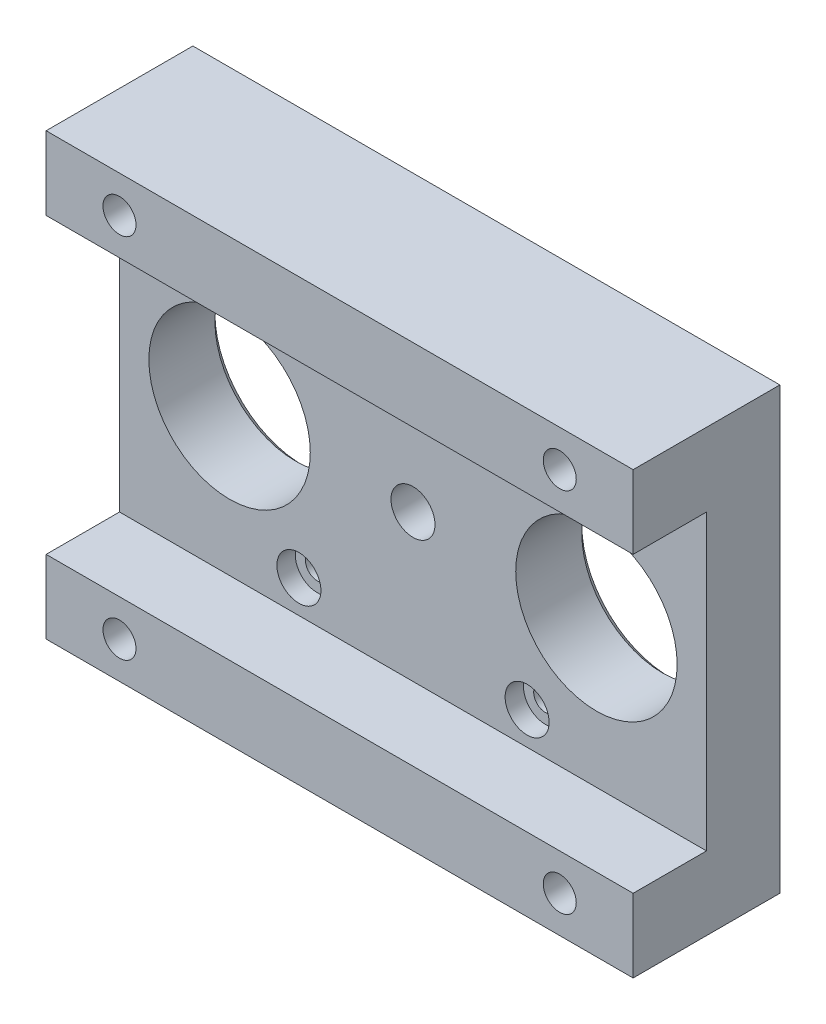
SolidWorks part; units mm, degrees
ref_plane "Ebene vorne" through (0, 0, 0) normal (0, 0, 1) x (1, 0, 0)
ref_plane "Ebene oben" through (0, 0, 0) normal (0, 1, 0) x (1, 0, 0)
ref_plane "Ebene rechts" through (0, 0, 0) normal (1, 0, 0) x (0, 0, -1)
sketch "Skizze1" plane through (0, 0, 0) normal (0, 0, 1) x (1, 0, 0)
  line L1 (-40, 30) -> (40, 30)
  line L2 (-40, 30) -> (-40, -30)
  line L3 (-40, -30) -> (40, -30)
  line L4 (40, 30) -> (40, -30)
  line L5 (-40, 30) -> (40, -30) construction
  line L6 (-40, -30) -> (40, 30) construction
  point P0 (0, 0)
  dimension "D1" = 80
  dimension "D2" = 60
extrude "Aufsatz-Linear austragen1" add sketch "Skizze1" along normal blind 10
sketch "Skizze2" plane through (0, 0, 10) normal (0, 0, 1) x (1, 0, 0)
  line L0 (40, -30) -> (40, 30) construction
  line L1 (-40, 30) -> (40, 30)
  line L2 (-40, 30) -> (-40, 20)
  line L3 (-40, 20) -> (40, 20)
  line L4 (40, 30) -> (40, 20)
  line L5 (-40, 30) -> (-40, -30) construction
  line L6 (40, -30) -> (-40, -30)
  line L7 (40, -30) -> (40, -20)
  line L8 (40, -20) -> (-40, -20)
  line L9 (-40, -30) -> (-40, -20)
  dimension "D1" = 10
  dimension "D2" = 10
extrude "Aufsatz-Linear austragen2" add sketch "Skizze2" along normal blind 10
sketch "Skizze3" plane through (0, 0, 0) normal (0, 0, -1) x (-1, 0, 0)
  circle A0 centre (0, 0) radius 11.35
  dimension "D1" = 22.7
extrude "Schnitt-Linear austragen1" cut sketch "Skizze3" against normal blind 2.2
sketch "Skizze4" plane through (0, 0, 2.2) normal (0, 0, -1) x (-1, 0, 0)
  circle A0 centre (0, 0) radius 3
extrude "Schnitt-Linear austragen2" cut sketch "Skizze4" against normal blind 12.2
sketch "Skizze5" plane through (0, 0, 20) normal (0, 0, 1) x (1, 0, 0)
  line L0 (-40, 20) -> (40, 20) construction
  line L1 (-40, -30) -> (40, -30) construction
  line L2 (40, -30) -> (40, -20) construction
  line L3 (40, 20) -> (40, 30) construction
  line L4 (-40, 30) -> (-40, 20) construction
  line L5 (-40, -20) -> (-40, -30) construction
  circle A0 centre (30, 25) radius 2.25
  circle A1 centre (-30, 25) radius 2.25
  circle A2 centre (-30, -25) radius 2.25
  circle A3 centre (30, -25) radius 2.25
  dimension "D1" = 4.5
  dimension "D2" = 4.5
  dimension "D3" = 4.5
  dimension "D4" = 4.5
  dimension "D5" = 5
  dimension "D6" = 5
  dimension "D7" = 5
  dimension "D8" = 5
  dimension "D9" = 10
  dimension "D10" = 10
  dimension "D11" = 10
  dimension "D12" = 10
extrude "Schnitt-Linear austragen3" cut sketch "Skizze5" against normal blind 12.2
sketch "Skizze6" plane through (0, 0, 10) normal (0, 0, 1) x (1, 0, 0)
  line L0 (40, -20) -> (40, 20) construction
  line L1 (-40, 20) -> (-40, -20) construction
  line L2 (-40, 20) -> (40, 20) construction
  line L3 (40, -20) -> (-40, -20) construction
  circle A0 centre (-25, 0) radius 11
  circle A1 centre (25, 0) radius 11
  dimension "D1" = 22
  dimension "D2" = 22
  dimension "D3" = 15
  dimension "D4" = 15
  dimension "D5" = 20
  dimension "D6" = 20
extrude "Schnitt-Linear austragen4" cut sketch "Skizze6" against normal blind 12.2
sketch "Skizze7" plane through (0, 0, 10) normal (0, 0, 1) x (1, 0, 0)
  line L1 (-15.55, 15.55) -> (15.55, 15.55)
  line L2 (-15.55, 15.55) -> (-15.55, -15.55)
  line L3 (-15.55, -15.55) -> (15.55, -15.55)
  line L4 (15.55, 15.55) -> (15.55, -15.55)
  line L5 (-15.55, 15.55) -> (15.55, -15.55) construction
  line L6 (-15.55, -15.55) -> (15.55, 15.55) construction
  circle A0 centre (-15.55, 15.55) radius 1.6
  circle A1 centre (15.55, 15.55) radius 1.6
  circle A2 centre (15.55, -15.55) radius 1.6
  circle A3 centre (-15.55, -15.55) radius 1.6
  point P0 (0, 0)
  dimension "D3" = 3.2
  dimension "D4" = 3.2
  dimension "D5" = 3.2
  dimension "D6" = 3.2
  dimension "D1" = 31.1
  dimension "D2" = 31.1
extrude "Schnitt-Linear austragen5" cut sketch "Skizze7" against normal blind 12.2 contours A0 | A1 | A2 | A3
sketch "Skizze8" plane through (0, 0, 10) normal (0, 0, 1) x (1, 0, 0)
  circle A0 centre (-15.55, 15.55) radius 3
  circle A1 centre (15.55, 15.55) radius 3
  circle A2 centre (-15.55, -15.55) radius 3
  circle A3 centre (15.55, -15.55) radius 3
extrude "Schnitt-Linear austragen6" cut sketch "Skizze8" against normal blind 2.5
chamfer "Fase1" distance 1 angle 45 2 edges at (36, 0, 0) (-14, 0, 0)
